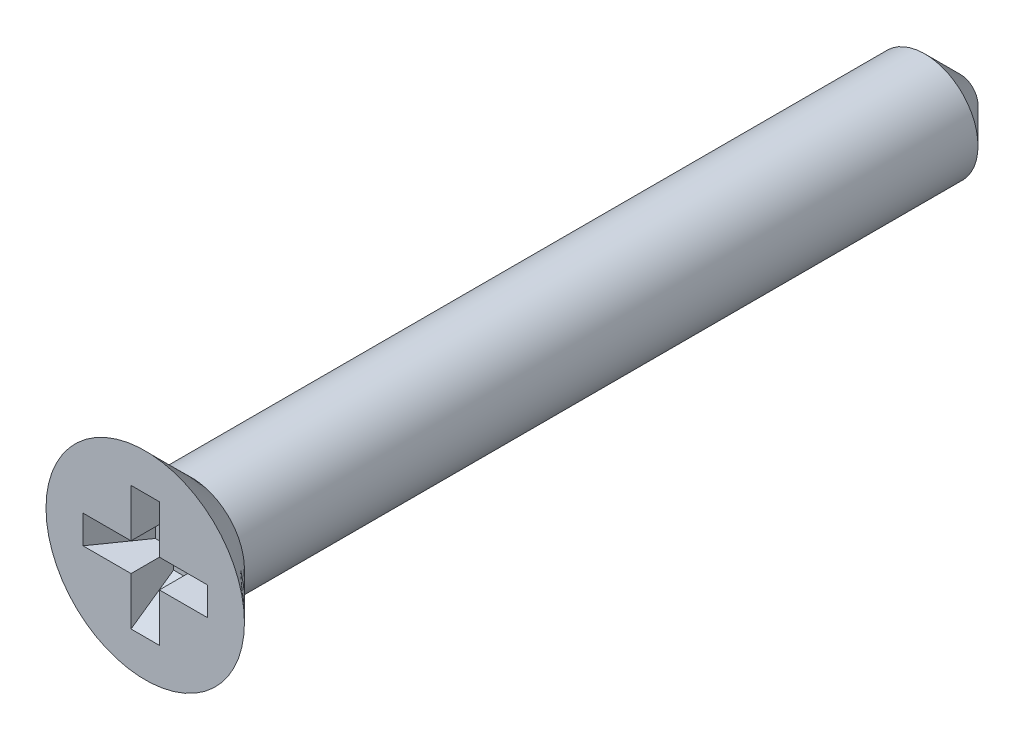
SolidWorks part; units mm, degrees
ref_plane "Plan de face" through (0, 0, 0) normal (0, 0, 1) x (1, 0, 0)
ref_plane "Plan de dessus" through (0, 0, 0) normal (0, 1, 0) x (1, 0, 0)
ref_plane "Plan de droite" through (0, 0, 0) normal (1, 0, 0) x (0, 0, -1)
sketch "Esquisse1" plane through (0, 0, 0) normal (1, 0, 0) x (0, 0, -1)
  line L0 (-1.6035, 0) -> (7.1529, 0) construction
  line L1 (0, 5.0438) -> (0, -4.594) construction
  line L2 (0, 2.8) -> (1.3, 1.5)
  line L3 (1.3, 1.5) -> (1.3, 0)
  line L4 (-1.442, 2.8) -> (2.7621, 2.8) construction
  line L5 (0, 2.8) -> (8.0274, -5.2274) construction
  line L6 (-1.0988, 1.5) -> (4.1029, 1.5) construction
  line L7 (1.3, 0) -> (0, 0)
  line L9 (0, 2.8) -> (0, 0)
revolve "Révolution2" add sketch "Esquisse1" angle 360 about L0
sketch "Esquisse3" plane through (0, 0, 0) normal (0, 0, 1) x (1, 0, 0)
  circle A0 centre (0, 0) radius 1.5
extrude "Extrusion1" add sketch "Esquisse3" against normal blind 23
sketch "Esquisse2" plane through (0, 0, 0) normal (0, 0, 1) x (1, 0, 0)
  line L0 (0.4, -0.4) -> (1.755, -0.4)
  line L1 (0.4, 0.4) -> (1.755, 0.4)
  line L2 (-1.755, -0.4) -> (-0.4, -0.4)
  line L3 (-0.4, 1.755) -> (-0.4, 0.4)
  line L4 (-1.755, 0.4) -> (-0.4, 0.4)
  line L5 (0.4, 1.755) -> (0.4, 0.4)
  line L6 (-0.4, 1.755) -> (0.4, 1.755)
  line L7 (1.755, 0.4) -> (1.755, -0.4)
  line L8 (0.4, -1.755) -> (-0.4, -1.755)
  line L9 (-1.755, -0.4) -> (-1.755, 0.4)
  line L10 (-0.4, -0.4) -> (-0.4, -1.755)
  line L12 (0.4, -0.4) -> (0.4, -1.755)
  circle A0 centre (0, 0) radius 1.8 construction
extrude "Enlèv. mat.-Extru.2" cut sketch "Esquisse2" against normal blind 1.2
draft "Dépouille3" type of draft neutral plane draft angle 35 faces to draft 4 parameters "D1"=35
chamfer "Chanfrein1" distance 1 angle 45 1 edges at (1.5, 0, -23)
